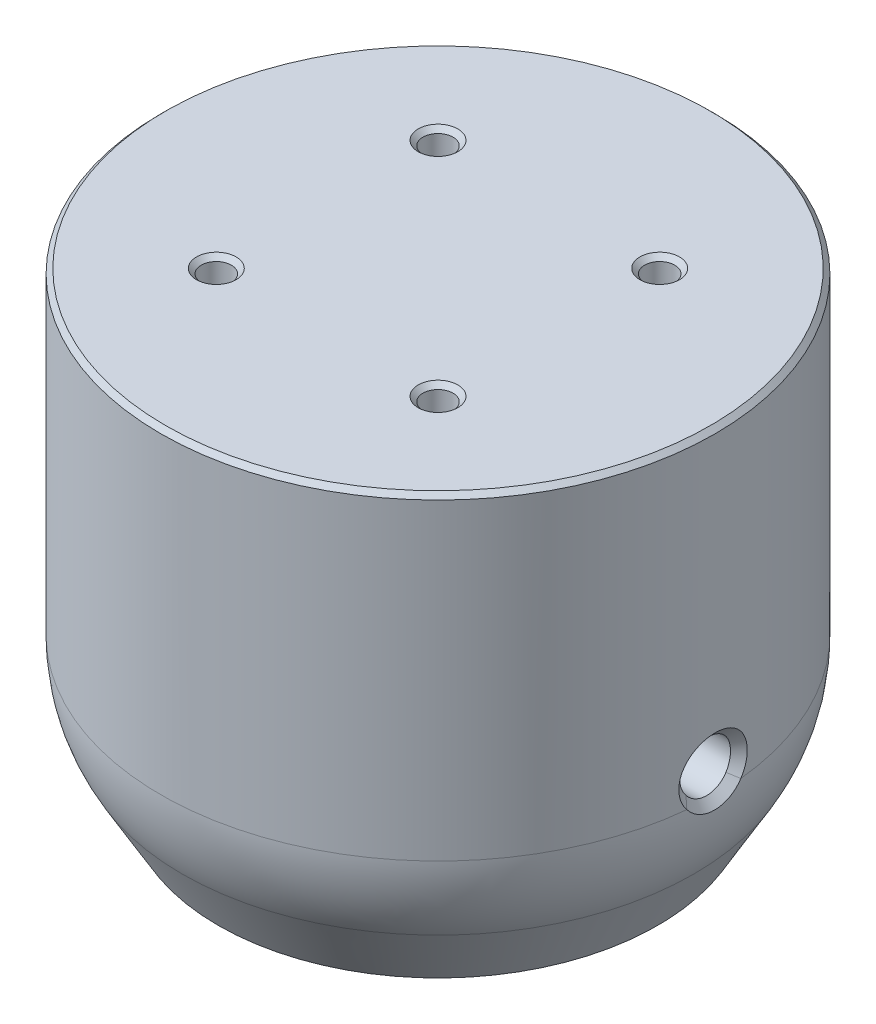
SolidWorks part; units mm, degrees
ref_plane "Ebene vorne" through (0, 0, 0) normal (0, 0, 1) x (1, 0, 0)
ref_plane "Ebene oben" through (0, 0, 0) normal (0, 1, 0) x (1, 0, 0)
ref_plane "Ebene rechts" through (0, 0, 0) normal (1, 0, 0) x (0, 0, -1)
sketch "Skizze1" plane through (0, 0, 0) normal (0, 0, 1) x (1, 0, 0)
  line L0 (25.75, -58) -> (25.75, -8)
  line L1 (25.75, -8) -> (0, -8)
  line L2 (0, -8) -> (0, 0)
  line L3 (0, 0) -> (35, 0)
  line L4 (35, 0) -> (35, -40.0836)
  line L5 (32.3205, -50.0836) -> (27.75, -58)
  line L6 (27.75, -58) -> (25.75, -58)
  line L8 (0, 0) -> (0, 25.2058) construction
  arc A0 (35, -40.0836) -> (32.3205, -50.0836) centre (15, -40.0836) cw
  dimension "D7" = 20
  dimension "D1" = 8
  dimension "D2" = 51.5
  dimension "D3" = 2
  dimension "D4" = 50
  dimension "D5" = 70
  dimension "D6" = 30
revolve "Rotation1" add sketch "Skizze1" angle 360 about L8
sketch "Skizze2" plane through (0, -8, 0) normal (0, -1, 0) x (-1, 0, 0)
  line L1 (-14, -14) -> (14, -14)
  line L2 (-14, -14) -> (-14, 14)
  line L3 (-14, 14) -> (14, 14)
  line L4 (14, -14) -> (14, 14)
  line L5 (-14, -14) -> (14, 14) construction
  line L6 (-14, 14) -> (14, -14) construction
  point P0 (-14, 14)
  point P2 (14, 14)
  point P4 (14, -14)
  point P6 (-14, -14)
  dimension "D1" = 28
hole_wizard "Stirnsenkung für M3 Zylinderschraube mit Innensechskant1" positions "Skizze2" profile "Skizze3" counterbore size "M3" standard "DIN"
sketch "Skizze3" plane through (14, -8, -14) normal (1, 0, 0) x (0, 0, -1)
  line L0 (0, 0) -> (0, 8)
  line L1 (0, 8) -> (1.9, 8)
  line L3 (1.9, 8) -> (1.9, 3.4)
  line L4 (1.9, 3.4) -> (3.25, 3.4)
  line L5 (3.25, 3.4) -> (3.25, 0)
  line L7 (3.25, 0) -> (0, 0)
  line L11 (0, -6.35) -> (0, 107.95) construction
  dimension "Bohrerdurchmesser" = 3.8
  dimension "Bohrungstiefe" = 8
  dimension "Senkdurchmesser2" = 6.5
  dimension "Senktiefe2" = 3.4
sketch "Skizze4" plane through (0, 0, 0) normal (1, 0, 0) x (0, 0, -1)
  line L0 (-25.75, -8) -> (25.75, -8) construction
  line L1 (0, 31.9) -> (0, -31.9) construction
  point P0 (0, -37.5)
  dimension "D1" = 29.5
hole_wizard "Ø6.4 (6.4) Durchmesser Bohrung1" positions "Skizze4" profile "Skizze7" hole size "Ø6.4" standard "DIN"
sketch "Skizze7" plane through (0, -37.5, 0) normal (0, 1, 0) x (0, 0, 1)
  line L0 (0, 0) -> (0, 35)
  line L1 (0, 35) -> (3.2, 35)
  line L2 (3.2, 35) -> (3.2, 0)
  line L5 (3.2, 0) -> (0, 0)
  line L11 (0, -6.35) -> (0, 107.95) construction
  dimension "Bohrerdurchmesser" = 6.4
  dimension "Bohrungstiefe" = 35
sketch "Skizze8" plane through (0, -8, 0) normal (0, -1, 0) x (1, 0, 0)
  line L0 (-25.25, 5.0498) -> (-25.25, -5.0498)
  circle A0 centre (0, 0) radius 25.75 construction
  arc A1 (-25.25, 5.0498) -> (-25.25, -5.0498) centre (0, 0) ccw
  dimension "D1" = 25.25
extrude "Aufsatz-Linear austragen1" add sketch "Skizze8" along normal blind 20
chamfer "Fase1" distance 1 angle 45 2 edges at (34.9967, -34.3363, -0.4807) (34.9903, -40.6972, -0.1349)
chamfer "Fase2" distance 0.6 angle 45 5 edges at (0, 0, -35) (-14, 0, 12.1) (14, 0, -15.9) (14, 0, 12.1) (-14, 0, -15.9)
chamfer "Fase3" distance 2 angle 20 1 edges at (25.75, -8, 0)
